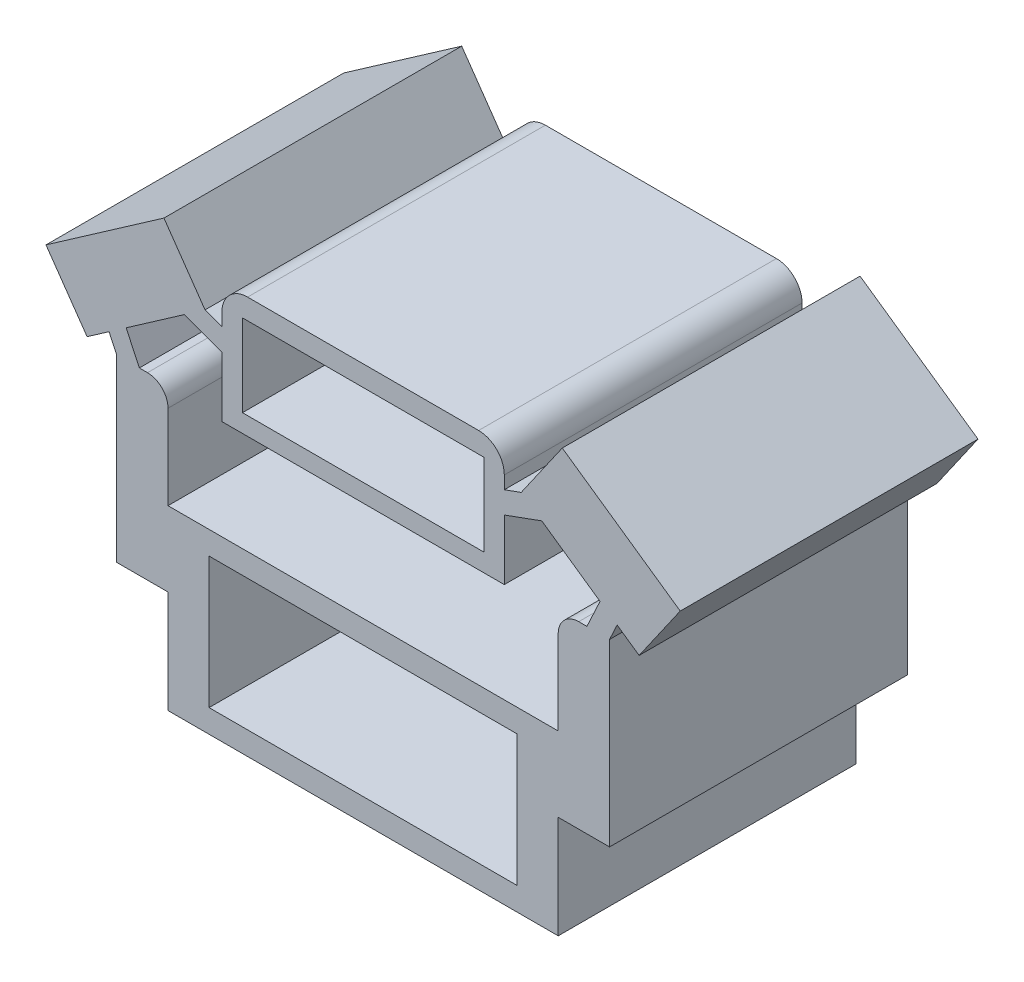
SolidWorks part; units mm, degrees
other "标注1"
sketch "草图17" plane through (-52.3494, -32.5127, 27.55) normal (0, 0, 1) x (1, 0, 0)
other "标注2"
sketch "草图18" plane through (1.1825, 3.3655, 3.4568) normal (0.1171, 0.0142, 0.993) x (0.9929, -0.0232, -0.1168)
ref_plane "前视基准面" through (0, 0, 0) normal (0, 0, 1) x (1, 0, 0)
ref_plane "上视基准面" through (0, 0, 0) normal (0, 1, 0) x (1, 0, 0)
ref_plane "右视基准面" through (0, 0, 0) normal (1, 0, 0) x (0, 0, -1)
other "Configuration Table"
sketch "草图1" plane through (0, 0, 0) normal (0, 0, 1) x (1, 0, 0)
  line L0 (2.75, 5.1) -> (3.0789, 5.2197)
  line L1 (-3.8, -1.4) -> (3.8, -1.4)
  line L2 (-3.8, -1.4) -> (-3.8, 1.4)
  line L4 (3.8, -1.4) -> (3.8, 0.1)
  line L5 (-3.8, -1.4) -> (3.8, 1.4) construction
  line L6 (-3.8, 1.4) -> (3.8, -1.4) construction
  line L7 (-2.75, 5.1) -> (2.75, 5.1)
  line L8 (-2.75, 5.1) -> (-2.75, 3.5)
  line L9 (-2.75, 3.5) -> (2.75, 3.5)
  line L10 (2.75, 4.6743) -> (2.75, 3.5)
  line L11 (-2.75, 5.1) -> (2.75, 3.5) construction
  line L12 (-2.75, 3.5) -> (2.75, 5.1) construction
  line L14 (3.8, 0.1) -> (4.8, 0.1)
  line L17 (3.8793, 6.3683) -> (3.0789, 5.2197)
  line L19 (3.8793, 6.3683) -> (6.1765, 4.7674)
  line L33 (2.75, 5.1) -> (2.75, 4.6743) construction
  line L34 (3.0789, 5.2197) -> (3.4801, 4.9401) construction
  line L37 (4.8, 3.6) -> (4.8, 0.1)
  line L38 (-3.8, 1.4) -> (3.8, 1.4)
  line L39 (3.8, 1.4) -> (3.8, 0.1) construction
  line L40 (0, 9.062) -> (0, -4.0269) construction
  line L41 (2.75, 4.6743) -> (3.4801, 4.9401)
  line L48 (3.4801, 4.9401) -> (4.6148, 4.1493)
  line L51 (4.3586, 3.6) -> (4.6148, 4.1493)
  line L53 (4.9479, 3.9172) -> (5.3761, 3.6188)
  line L55 (4.6148, 4.1493) -> (4.9479, 3.9172) construction
  line L56 (4.3586, 3.6) -> (4.8, 3.6) construction
  line L57 (3.8, 1.4) -> (3.8, 3.6)
  line L58 (3.8, 3.6) -> (4.3586, 3.6)
  line L59 (4.8, 3.6) -> (4.9479, 3.9172)
  line L60 (5.3761, 3.6188) -> (6.1765, 4.7674)
  point P0 (0, 0)
  point P6 (0, 4.3)
  dimension "D1" = 7.6
  dimension "D2" = 2.8
  dimension "D3" = 5.5
  dimension "D4" = 1.6
  dimension "D5" = 1
  dimension "D6" = 65
  dimension "D7" = 0.35
  dimension "D8" = 0.4
  dimension "D9" = 3.5
  dimension "D10" = 1.4
  dimension "D11" = 0.4
  dimension "D12" = 2.2
  dimension "D13" = 0.35
  dimension "D14" = 2.1
  dimension "D15" = 2.8
  dimension "D16" = 110
extrude "凸台-拉伸1" add sketch "草图1" along normal blind 5.8
mirror "镜向1" about plane through (0, 0, 0) normal (1, 0, 0) of "凸台-拉伸1"
sketch "草图10" plane through (0, 0, 5.8) normal (0, 0, 1) x (1, 0, 0)
  line L0 (-2.75, 3.5) -> (2.75, 3.5) construction
  line L1 (-3, -1.05) -> (3, -1.05)
  line L2 (-3, -1.05) -> (-3, 1.05)
  line L3 (-3, 1.05) -> (3, 1.05)
  line L4 (3, -1.05) -> (3, 1.05)
  line L5 (-3, -1.05) -> (3, 1.05) construction
  line L6 (-3, 1.05) -> (3, -1.05) construction
  line L7 (-2.35, 5.45) -> (2.35, 5.45)
  line L8 (-2.35, 5.45) -> (-2.35, 3.85)
  line L9 (-2.35, 3.85) -> (2.35, 3.85)
  line L10 (2.35, 5.45) -> (2.35, 3.85)
  point P0 (0, 0)
  point P10 (0, 5.45)
  dimension "D1" = 6
  dimension "D2" = 2.1
  dimension "D3" = 4.7
  dimension "D4" = 1.6
  dimension "D5" = 0.35
extrude "切除-拉伸3" cut sketch "草图10" against normal through all
sketch "草图11" plane through (0, 0, 5.8) normal (0, 0, 1) x (1, 0, 0)
  line L0 (-2.35, 5.1) -> (-2.75, 5.1)
  line L1 (-2.75, 5.1) -> (-2.75, 5.85)
  line L2 (-2.75, 5.85) -> (2.75, 5.85)
  line L3 (2.75, 5.85) -> (2.75, 5.1)
  line L4 (2.75, 3.5) -> (2.75, 4.6743) construction
  line L5 (2.75, 5.1) -> (2.35, 5.1)
  line L6 (2.35, 5.1) -> (2.35, 5.45)
  line L7 (2.35, 5.45) -> (-2.35, 5.45)
  line L8 (-2.35, 5.45) -> (-2.35, 5.1)
  line L9 (-2.35, 3.85) -> (2.35, 3.85) construction
  dimension "D1" = 0.4
  dimension "D2" = 1.6
extrude "凸台-拉伸2" add sketch "草图11" against normal up to surface (5.8 mm away)
fillet "圆角1" radius 0.5 2 edges at (-2.75, 5.85, 2.9) (2.75, 5.85, 2.9)
sketch "草图12" plane through (0, 0, 5.8) normal (0, 0, 1) x (1, 0, 0)
  line L0 (-3, 1.05) -> (-3, -1.05) construction
  line L1 (-3, 0.95) -> (3, 0.95)
  line L2 (-3, 0.95) -> (-3, 1.05)
  line L3 (-3, 1.05) -> (3, 1.05)
  line L4 (3, 0.95) -> (3, 1.05)
  line L5 (3.8, -1.4) -> (3.8, 0.1) construction
  line L6 (-3.8, -1.4) -> (3.8, -1.4)
  line L7 (-3.8, -1.4) -> (-3.8, -1.9)
  line L8 (-3.8, -1.9) -> (3.8, -1.9)
  line L9 (3.8, -1.4) -> (3.8, -1.9)
  dimension "D1" = 0.1
  dimension "D2" = 0.5
extrude "凸台-拉伸3" add sketch "草图12" against normal up to surface (5.8 mm away)
sketch "草图14" plane through (0, 0, 5.8) normal (0, 0, 1) x (1, 0, 0)
  line L0 (3, -1.05) -> (3, 0.95) construction
  line L1 (-3, -1.05) -> (3, -1.05)
  line L2 (-3, -1.05) -> (-3, -1.45)
  line L3 (-3, -1.45) -> (3, -1.45)
  line L4 (3, -1.05) -> (3, -1.45)
  dimension "D1" = 0.4
extrude "切除-拉伸4" cut sketch "草图14" against normal through all
sketch "草图15" plane through (0, 0, 5.8) normal (0, 0, 1) x (1, 0, 0)
  line L0 (0, 5.1) -> (0, 1.4)
  line L2 (3.8, 1.4) -> (-3.8, 1.4) construction
  line L3 (0, 1.4) -> (3.8, 1.4)
  line L4 (3.8, 1.4) -> (3.8, 3.6)
  line L5 (3.8, 3.6) -> (4.8, 3.6)
  line L6 (4.8, 3.6) -> (4.9479, 3.9172)
  line L7 (4.9479, 3.9172) -> (3.0789, 5.2197)
  line L8 (3.0789, 5.2197) -> (2.75, 5.1)
  line L9 (2.75, 5.1) -> (0, 5.1)
sketch "草图16" plane through (0, 0, 5.8) normal (0, 0, 1) x (1, 0, 0)
  line L0 (-2.35, 5.45) -> (-2.35, 3.85) construction
  line L1 (-2.35, 3.95) -> (2.35, 3.95)
  line L2 (-2.35, 3.95) -> (-2.35, 3.85)
  line L3 (-2.35, 3.85) -> (2.35, 3.85)
  line L4 (2.35, 3.95) -> (2.35, 3.85)
  dimension "D1" = 0.1
extrude "凸台-拉伸4" [suppressed] add sketch "草图16" against normal up to surface (5.8 mm away)
fillet "圆角2" radius 0.4 2 edges at (-3.8, 3.6, 2.9) (3.8, 3.6, 2.9)
scale "缩放比例1" scale about centroid uniform scaling yes scale factor 0.192
sketch "草图19" plane through (0, 0, 3.4568) normal (0, 0, 1) x (1, 0, 0)
  line L0 (0.7296, 2.603) -> (0.7296, 2.2574) construction
  line L1 (-0.7296, 2.2574) -> (0.7296, 2.2574)
  line L2 (-0.7296, 2.2574) -> (-0.7296, 2.2874)
  line L3 (-0.7296, 2.2874) -> (0.7296, 2.2874)
  line L4 (0.7296, 2.2574) -> (0.7296, 2.2874)
  dimension "D1" = 0.03
extrude "凸台-拉伸5" add sketch "草图19" against normal up to surface (1.1136 mm away)
sketch "草图20" plane through (0, 0, 3.4568) normal (0, 0, 1) x (1, 0, 0)
  line L0 (0.576, 1.7102) -> (0.576, 2.171) construction
  line L1 (-0.576, 2.171) -> (0.576, 2.171)
  line L2 (-0.576, 2.171) -> (-0.576, 2.201)
  line L3 (-0.576, 2.201) -> (0.576, 2.201)
  line L4 (0.576, 2.171) -> (0.576, 2.201)
  dimension "D1" = 0.03
extrude "切除-拉伸5" cut sketch "草图20" against normal through all
